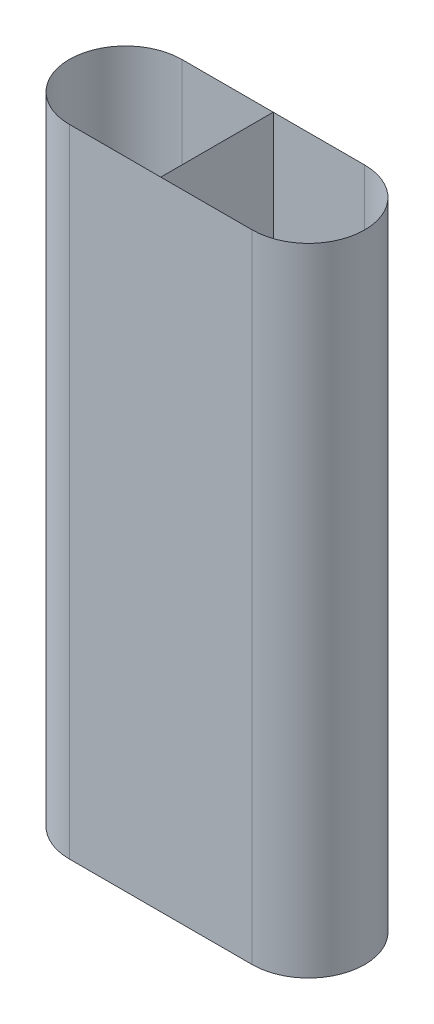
SolidWorks part; units mm, degrees
other "DetailItem28"
other "DetailItem29"
other "DetailItem30"
other "Grid System1" parameters "D1"=400, "D2"=400, "D3"=0, "D4"=0
sketch "Sketch1" plane through (0, 0, 0) normal (0, 1, 0) x (1, 0, 0)
  line L0 (-56.5021, 0) -> (58.4777, 0) construction
  line L1 (-56.5021, 35.3632) -> (58.4777, 35.3632)
  line L2 (-56.5021, -35.3632) -> (58.4777, -35.3632)
  line L3 (0.9878, -35.3632) -> (0.9878, 35.3632)
  arc A0 (-56.5021, 35.3632) -> (-56.5021, -35.3632) centre (-56.5021, 0) ccw
  arc A1 (58.4777, -35.3632) -> (58.4777, 35.3632) centre (58.4777, 0) ccw
  point P8 (-56.5021, 35.3632)
  point P9 (58.4777, 35.3632)
  point P10 (-56.5021, -35.3632)
  point P11 (58.4777, -35.3632)
  point P17 (0.9878, 35.3632)
  point P18 (0.9878, -35.3632)
ref_plane "Level1" through (0, 100, 0) normal (0, 1, 0) x (1, 0, 0)
sketch "Sketch2" plane through (0, 100, 0) normal (0, 1, 0) x (1, 0, 0)
  line L0 (-56.5021, 0) -> (58.4777, 0) construction
  line L1 (-56.5021, 35.3632) -> (58.4777, 35.3632)
  line L2 (-56.5021, -35.3632) -> (58.4777, -35.3632)
  line L3 (0.9878, -35.3632) -> (0.9878, 35.3632)
  arc A0 (-56.5021, 35.3632) -> (-56.5021, -35.3632) centre (-56.5021, 0) ccw
  arc A1 (58.4777, -35.3632) -> (58.4777, 35.3632) centre (58.4777, 0) ccw
  point P8 (-56.5021, 35.3632)
  point P9 (58.4777, 35.3632)
  point P10 (-56.5021, -35.3632)
  point P11 (58.4777, -35.3632)
  point P17 (0.9878, 35.3632)
  point P18 (0.9878, -35.3632)
ref_plane "Level2" through (0, 200, 0) normal (0, 1, 0) x (1, 0, 0)
sketch "Sketch3" plane through (0, 200, 0) normal (0, 1, 0) x (1, 0, 0)
  line L0 (-56.5021, 0) -> (58.4777, 0) construction
  line L1 (-56.5021, 35.3632) -> (58.4777, 35.3632)
  line L2 (-56.5021, -35.3632) -> (58.4777, -35.3632)
  line L3 (0.9878, -35.3632) -> (0.9878, 35.3632)
  arc A0 (-56.5021, 35.3632) -> (-56.5021, -35.3632) centre (-56.5021, 0) ccw
  arc A1 (58.4777, -35.3632) -> (58.4777, 35.3632) centre (58.4777, 0) ccw
  point P8 (-56.5021, 35.3632)
  point P9 (58.4777, 35.3632)
  point P10 (-56.5021, -35.3632)
  point P11 (58.4777, -35.3632)
  point P17 (0.9878, 35.3632)
  point P18 (0.9878, -35.3632)
ref_plane "Level3" through (0, 300, 0) normal (0, 1, 0) x (1, 0, 0)
sketch "Sketch4" plane through (0, 300, 0) normal (0, 1, 0) x (1, 0, 0)
  line L0 (-56.5021, 0) -> (58.4777, 0) construction
  line L1 (-56.5021, 35.3632) -> (58.4777, 35.3632)
  line L2 (-56.5021, -35.3632) -> (58.4777, -35.3632)
  line L3 (0.9878, -35.3632) -> (0.9878, 35.3632)
  arc A0 (-56.5021, 35.3632) -> (-56.5021, -35.3632) centre (-56.5021, 0) ccw
  arc A1 (58.4777, -35.3632) -> (58.4777, 35.3632) centre (58.4777, 0) ccw
  point P8 (-56.5021, 35.3632)
  point P9 (58.4777, 35.3632)
  point P10 (-56.5021, -35.3632)
  point P11 (58.4777, -35.3632)
  point P17 (0.9878, 35.3632)
  point P18 (0.9878, -35.3632)
ref_plane "Level4" through (0, 400, 0) normal (0, 1, 0) x (1, 0, 0)
sketch "Sketch5" plane through (0, 400, 0) normal (0, 1, 0) x (1, 0, 0)
  line L0 (-56.5021, 0) -> (58.4777, 0) construction
  line L1 (-56.5021, 35.3632) -> (58.4777, 35.3632)
  line L2 (-56.5021, -35.3632) -> (58.4777, -35.3632)
  line L3 (0.9878, -35.3632) -> (0.9878, 35.3632)
  arc A0 (-56.5021, 35.3632) -> (-56.5021, -35.3632) centre (-56.5021, 0) ccw
  arc A1 (58.4777, -35.3632) -> (58.4777, 35.3632) centre (58.4777, 0) ccw
  point P8 (-56.5021, 35.3632)
  point P9 (58.4777, 35.3632)
  point P10 (-56.5021, -35.3632)
  point P11 (58.4777, -35.3632)
  point P17 (0.9878, 35.3632)
  point P18 (0.9878, -35.3632)
sketch3d "3DSketch1"
  line L0 (-56.5021, 0, -35.3632) -> (-56.5021, 100, -35.3632)
  line L1 (-56.5021, 100, -35.3632) -> (-56.5021, 200, -35.3632)
  line L2 (-56.5021, 200, -35.3632) -> (-56.5021, 300, -35.3632)
  line L3 (-56.5021, 300, -35.3632) -> (-56.5021, 400, -35.3632)
  line L4 (58.4777, 0, -35.3632) -> (58.4777, 100, -35.3632)
  line L5 (58.4777, 100, -35.3632) -> (58.4777, 200, -35.3632)
  line L6 (58.4777, 200, -35.3632) -> (58.4777, 300, -35.3632)
  line L7 (58.4777, 300, -35.3632) -> (58.4777, 400, -35.3632)
  line L8 (-56.5021, 0, 35.3632) -> (-56.5021, 100, 35.3632)
  line L9 (-56.5021, 100, 35.3632) -> (-56.5021, 200, 35.3632)
  line L10 (-56.5021, 200, 35.3632) -> (-56.5021, 300, 35.3632)
  line L11 (-56.5021, 300, 35.3632) -> (-56.5021, 400, 35.3632)
  line L12 (58.4777, 0, 35.3632) -> (58.4777, 100, 35.3632)
  line L13 (58.4777, 100, 35.3632) -> (58.4777, 200, 35.3632)
  line L14 (58.4777, 200, 35.3632) -> (58.4777, 300, 35.3632)
  line L15 (58.4777, 300, 35.3632) -> (58.4777, 400, 35.3632)
  line L16 (0.9878, 0, -35.3632) -> (0.9878, 100, -35.3632)
  line L17 (0.9878, 100, -35.3632) -> (0.9878, 200, -35.3632)
  line L18 (0.9878, 200, -35.3632) -> (0.9878, 300, -35.3632)
  line L19 (0.9878, 300, -35.3632) -> (0.9878, 400, -35.3632)
  line L20 (0.9878, 0, 35.3632) -> (0.9878, 100, 35.3632)
  line L21 (0.9878, 100, 35.3632) -> (0.9878, 200, 35.3632)
  line L22 (0.9878, 200, 35.3632) -> (0.9878, 300, 35.3632)
  line L23 (0.9878, 300, 35.3632) -> (0.9878, 400, 35.3632)
surface "Surface-Extrude1" sketch "Sketch1"
ref_plane "Front Plane" through (0, 0, 0) normal (0, 0, 1) x (1, 0, 0)
ref_plane "Top Plane" through (0, 0, 0) normal (0, 1, 0) x (1, 0, 0)
ref_plane "Right Plane" through (0, 0, 0) normal (1, 0, 0) x (0, 0, -1)
